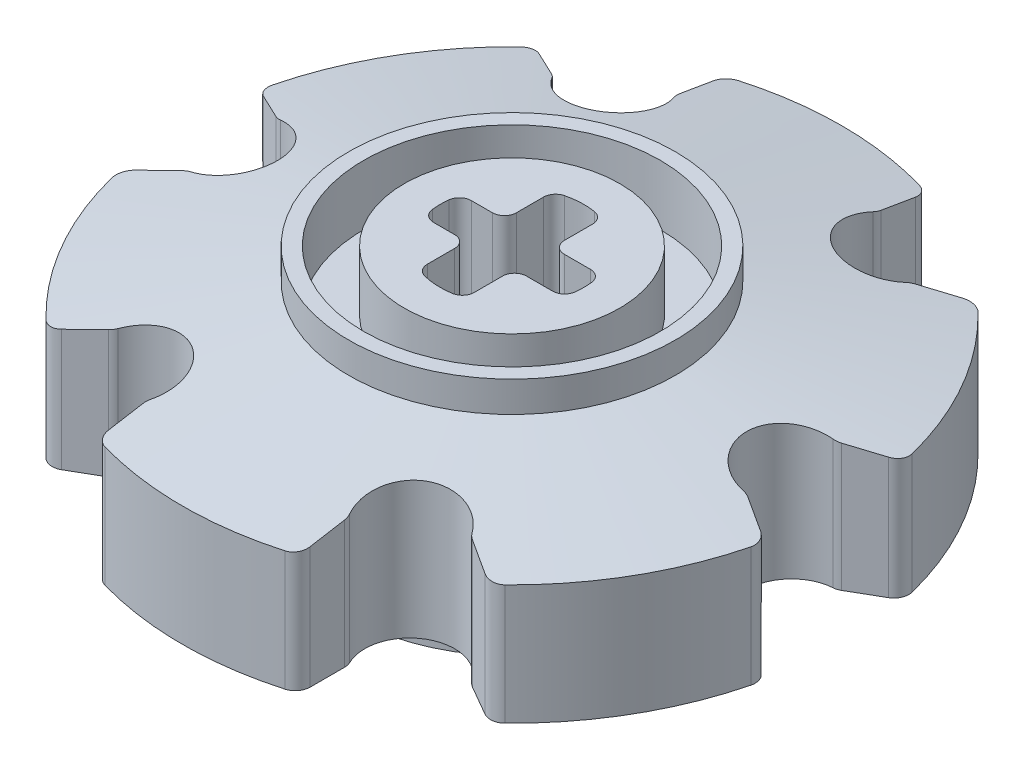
SolidWorks part; units mm, degrees
ref_plane "정면" through (0, 0, 0) normal (0, 0, 1) x (1, 0, 0)
ref_plane "윗면" through (0, 0, 0) normal (0, 1, 0) x (1, 0, 0)
ref_plane "우측면" through (0, 0, 0) normal (1, 0, 0) x (0, 0, -1)
sketch "스케치1" plane through (0, 0, 0) normal (0, 0, 1) x (1, 0, 0)
  line L0 (0, -6.2705) -> (0, 5.1377) construction
  line L1 (11, 1.9785) -> (5.45, 2.9785)
  line L2 (5.45, 2.9785) -> (5.45, 4)
  line L3 (10.5, -2.0215) -> (10.5, 1.5606)
  line L4 (5.45, 4) -> (4.95, 4)
  line L5 (11, -2.0215) -> (11, 1.9785)
  line L6 (4.95, 4) -> (4.95, 1.9948)
  line L7 (4.95, -4) -> (5.45, -4)
  line L8 (10.5, 1.5606) -> (5.45, 2.4705)
  line L9 (5.45, -4) -> (5.45, 2.4705)
  line L10 (10.5, -2.0215) -> (11, -2.0215)
  line L11 (0, 4) -> (3.6, 4)
  line L12 (3.6, 4) -> (3.6, 1.9948)
  line L13 (3.6, 1.9948) -> (4.95, 1.9948)
  line L14 (3.6, -1.9948) -> (4.95, -1.9948)
  line L15 (4.95, -2.0377) -> (4.95, -4)
  line L16 (0, 0) -> (23.5322, 0) construction
  line L17 (3.6, -4) -> (3.6, -1.9948)
  line L18 (0, -4) -> (3.6, -4)
  line L19 (0, 4) -> (0, -4)
  line L20 (4.95, -1.9948) -> (4.95, -2.0377)
  point P3 (13.5304, -0.0215)
  dimension "D1" = 0.5
  dimension "D2" = 0.5
  dimension "D3" = 0.5
  dimension "D4" = 0.5
  dimension "D5" = 8
  dimension "D6" = 11
  dimension "D7" = 5.05
  dimension "D8" = 3.6
  dimension "D9" = 1
revolve "회전1" add sketch "스케치1" angle 360 about L0
sketch "스케치2" plane through (0, 0, 0) normal (0, 1, 0) x (1, 0, 0)
  line L0 (0.7155, 0.6311) -> (2.3155, 0.6311)
  line L1 (0.7155, -0.6311) -> (2.3155, -0.6311)
  line L2 (-0.8845, -2.2311) -> (-0.8845, -0.6311)
  line L3 (-0.8845, 0.6311) -> (-0.8845, 2.2311)
  line L4 (0.7155, -2.2909) -> (0.7155, -0.6311)
  line L5 (-2.3155, -0.6311) -> (-0.8845, -0.6311)
  line L6 (0.7155, 0.6311) -> (0.7155, 2.2909)
  line L7 (-2.3155, 0.6311) -> (-0.8845, 0.6311)
  arc A0 (-2.3155, 0.6311) -> (-2.3155, -0.6311) centre (0, 0) ccw
  arc A1 (0.7155, 2.2909) -> (-0.8845, 2.2311) centre (0, 0) ccw
  arc A2 (2.3155, -0.6311) -> (2.3155, 0.6311) centre (0, 0) ccw
  arc A3 (-0.8845, -2.2311) -> (0.7155, -2.2909) centre (0, 0) ccw
extrude "컷-돌출1" cut sketch "스케치2" against normal through all both and the other way through all
sketch "스케치3" plane through (0, 0, 0) normal (0, 1, 0) x (1, 0, 0)
  line L0 (9.3307, 0) -> (19.2797, 0) construction
  line L1 (9.3307, 1.5) -> (10.7524, 2.3208)
  line L2 (9.3307, -1.5) -> (10.7524, -2.3208)
  arc A0 (9.3307, 1.5) -> (9.3307, -1.5) centre (9.3307, 0) ccw
  circle A1 centre (0, 0) radius 11 construction
  point P7 (7.8307, 0)
  dimension "D1" = 1.5
  dimension "D2" = 30
  dimension "D3" = 1.6416
extrude "컷-돌출2" cut sketch "스케치3" against normal through all both and the other way through all
sketch "스케치4" plane through (0, 0, 0) normal (0, 1, 0) x (1, 0, 0)
  line L0 (9.3307, 0) -> (22.9881, 0) construction
  line L1 (9.3307, 1.5) -> (10.3194, 2.0708)
  line L2 (9.3307, -1.5) -> (10.3194, -2.0708)
  arc A0 (9.3307, 1.5) -> (9.3307, -1.5) centre (9.3307, 0) ccw
  arc A1 (9.3307, 1.5) -> (9.3307, -1.5) centre (9.3307, 0) ccw construction
  point P6 (7.8307, 0)
  dimension "D1" = 1.5
  dimension "D2" = 30
  dimension "D3" = 1.1416
extrude "돌출-얇게1" add sketch "스케치4" along normal up to next and the other way up to surface thin
fillet "필렛1" radius 0.5 4 edges at (10.7524, -0.0215, -2.3208) (9.3307, 0.1181, -1.5) (10.7524, -0.0215, 2.3208) (9.3307, 0.1181, 1.5)
pattern_circular "원형 패턴1" count 6 over 360 about axis through (0, 0, 0) along (0, 1, 0) of "컷-돌출2", "필렛1", "돌출-얇게1"
fillet "필렛2" radius 0.4 12 edges at (0.7155, 0, 2.2909) (-0.8845, 0, 2.2311) (-2.3155, 0, 0.6311) (-2.3155, 0, -0.6311) (-0.8845, 0, -2.2311) (0.7155, 0, -2.2909) (2.3155, 0, -0.6311) (2.3155, 0, 0.6311) (0.7155, 0, 0.6311) (-0.8845, 0, 0.6311) (-0.8845, 0, -0.6311) (0.7155, 0, -0.6311)
